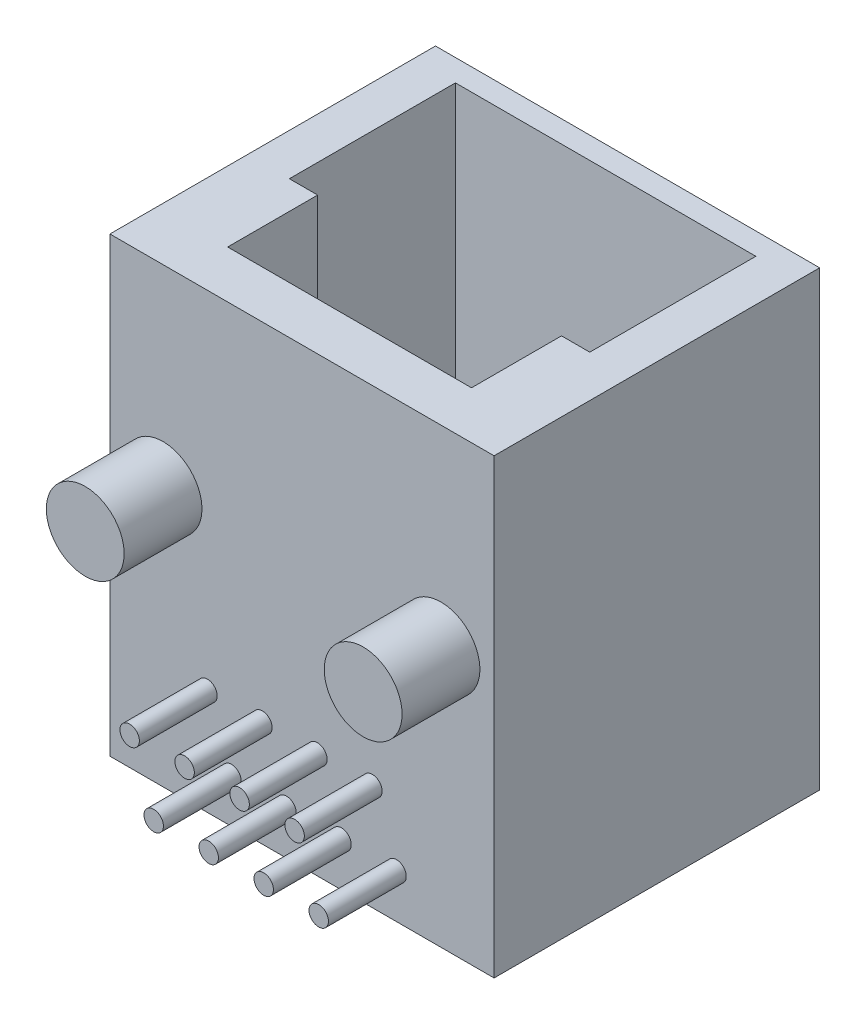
SolidWorks part; units mm, degrees
ref_plane "Front Plane" through (0, 0, 0) normal (0, 0, 1) x (1, 0, 0)
ref_plane "Top Plane" through (0, 0, 0) normal (0, 1, 0) x (1, 0, 0)
ref_plane "Right Plane" through (0, 0, 0) normal (1, 0, 0) x (0, 0, -1)
sketch "Sketch1" plane through (0, 0, 0) normal (0, 1, 0) x (1, 0, 0)
  line L1 (-7.9, -6.695) -> (7.9, -6.695)
  line L2 (-7.9, -6.695) -> (-7.9, 6.695)
  line L3 (-7.9, 6.695) -> (7.9, 6.695)
  line L4 (7.9, -6.695) -> (7.9, 6.695)
  line L5 (-7.9, -6.695) -> (7.9, 6.695) construction
  line L6 (-7.9, 6.695) -> (7.9, -6.695) construction
  point P0 (0, 0)
  dimension "D1" = 15.8
  dimension "D2" = 13.39
extrude "Boss-Extrude1" add sketch "Sketch1" along normal blind 18.6
sketch "Sketch2" plane through (0, 18.6, 0) normal (0, 1, 0) x (1, 0, 0)
  line L0 (0, 6.5971) -> (0, -6.695) construction
  line L1 (-7.9, -6.695) -> (7.9, -6.695) construction
  line L2 (5.0149, -1.0369) -> (6.177, -1.0369)
  line L3 (-6.177, -1.0369) -> (-5.0149, -1.0369)
  line L4 (-6.177, -1.0369) -> (-6.177, 5.7926)
  line L5 (-6.177, 5.7926) -> (6.177, 5.7926)
  line L6 (6.177, -1.0369) -> (6.177, 5.7926)
  line L7 (-6.177, -1.0369) -> (6.177, 5.7926) construction
  line L8 (-6.177, 5.7926) -> (6.177, -1.0369) construction
  line L9 (-5.0149, -4.7378) -> (5.0149, -4.7378)
  line L10 (-5.0149, -4.7378) -> (-5.0149, -1.0369)
  line L12 (5.0149, -4.7378) -> (5.0149, -1.0369)
  line L13 (-5.0149, -4.7378) -> (5.0149, -1.0369) construction
  line L14 (-5.0149, -1.0369) -> (5.0149, -4.7378) construction
  point P4 (0, 2.3778)
  point P9 (0, -2.8874)
  point P14 (-5.0149, -0.0179)
extrude "Cut-Extrude1" cut sketch "Sketch2" against normal blind 14.6
sketch "Sketch3" plane through (0, 0, 6.695) normal (0, 0, 1) x (1, 0, 0)
  line L0 (-7.9, 10.7) -> (-7.315, 10.7) construction
  line L1 (-7.9, 18.6) -> (-7.9, 0) construction
  line L2 (7.9, 18.6) -> (7.9, 0) construction
  line L3 (-7.9, 4.35) -> (7.9, 4.35) construction
  line L4 (7.9, 4.35) -> (7.9, 1.81) construction
  line L5 (7.9, 1.81) -> (-7.9, 1.81) construction
  line L6 (-7.9, 18.6) -> (7.9, 18.6) construction
  line L7 (7.315, 10.7) -> (7.9, 10.7) construction
  circle A0 centre (-5.715, 10.7) radius 1.6
  circle A1 centre (5.715, 10.7) radius 1.6
  circle A4 centre (2.896, 4.35) radius 0.4
  circle A5 centre (0.634, 4.35) radius 0.4
  circle A6 centre (-1.628, 4.35) radius 0.4
  circle A8 centre (3.888, 1.81) radius 0.4
  circle A9 centre (1.626, 1.81) radius 0.4
  circle A10 centre (-0.636, 1.81) radius 0.4
  circle A11 centre (-2.898, 1.81) radius 0.4
  circle A12 centre (-3.888, 4.35) radius 0.4
  point P16 (0, 18.6)
  dimension "D1" = 0.8
  dimension "D15" = 3.2
  dimension "D2" = 2.262
  dimension "D3" = 2.262
  dimension "D4" = 1.27
  dimension "D5" = 2.262
  dimension "D6" = 2.26
  dimension "D7" = 2.262
  dimension "D8" = 2.262
  dimension "D9" = 3.888
  dimension "D11" = 2.54
  dimension "D12" = 8.89
  dimension "D13" = 7.9
  dimension "D16" = 11.43
extrude "Boss-Extrude2" add sketch "Sketch3" along normal blind 3.2
equation "\"pin dist\"=2.26198"
